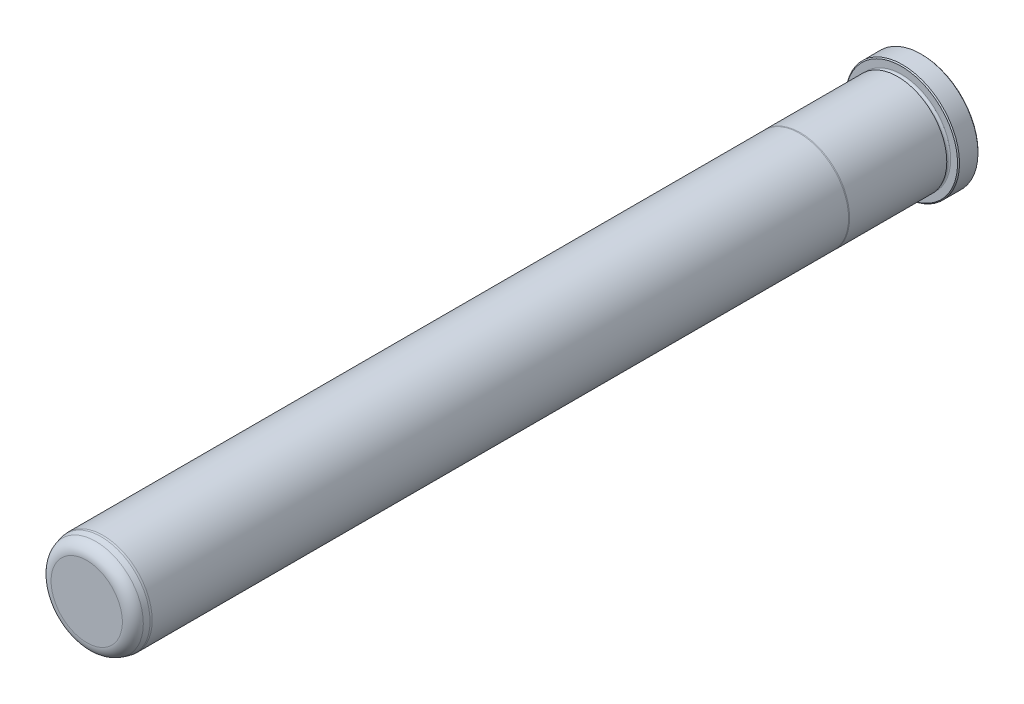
SolidWorks part; units mm, degrees
ref_plane "Front Plane" through (0, 0, 0) normal (0, 0, 1) x (1, 0, 0)
ref_plane "Top Plane" through (0, 0, 0) normal (0, 1, 0) x (1, 0, 0)
ref_plane "Right Plane" through (0, 0, 0) normal (1, 0, 0) x (0, 0, -1)
sketch "Sketch1" plane through (0, 0, 0) normal (1, 0, 0) x (0, 0, -1)
  line L0 (0, 0) -> (0, 22.098)
  line L1 (0, 22.098) -> (-7.9248, 22.098)
  line L2 (-7.9248, 22.098) -> (-7.9248, 19.0373)
  line L3 (-7.9248, 18.2753) -> (-9.4488, 18.2753) construction
  line L4 (-9.4488, 19.0373) -> (-9.4488, 19.0627)
  line L5 (-9.4488, 19.0627) -> (-47.1348, 19.0627)
  line L6 (-47.1348, 19.0627) -> (-47.498, 19.0373)
  line L7 (-47.498, 19.0373) -> (-317.5, 19.0373)
  line L9 (-323.85, 17.4733) -> (-323.85, 0)
  line L10 (-323.85, 0) -> (0, 0)
  line L11 (0, 0) -> (13.6287, 0) construction
  line L12 (-317.5, 19.0373) -> (-318.262, 18.9706)
  line L13 (-318.262, 18.9706) -> (-323.85, 17.4733)
  arc A0 (-9.4488, 19.0373) -> (-7.9248, 19.0373) centre (-8.6868, 19.0373) ccw
  dimension "D14" = 1.524
  dimension "D1" = 7.9248
  dimension "D2" = 1.524
  dimension "D3" = 44.196
  dimension "D4" = 38.1254
  dimension "D5" = 47.498
  dimension "D6" = 323.85
  dimension "D7" = 0.7874
  dimension "D8" = 4
  dimension "D9" = 38.0746
  dimension "D10" = 5
  dimension "D11" = 15
  dimension "D12" = 0.762
  dimension "D13" = 6.35
revolve "Revolve1" add sketch "Sketch1" angle 360 about L11
fillet "Fillet6" radius 4.7625 1 edges at (17.4733, 0, 323.85)
chamfer "Chamfer1" distance 0.381 angle 45 2 edges at (22.098, 0, 0) (22.098, 0, 7.9248)
